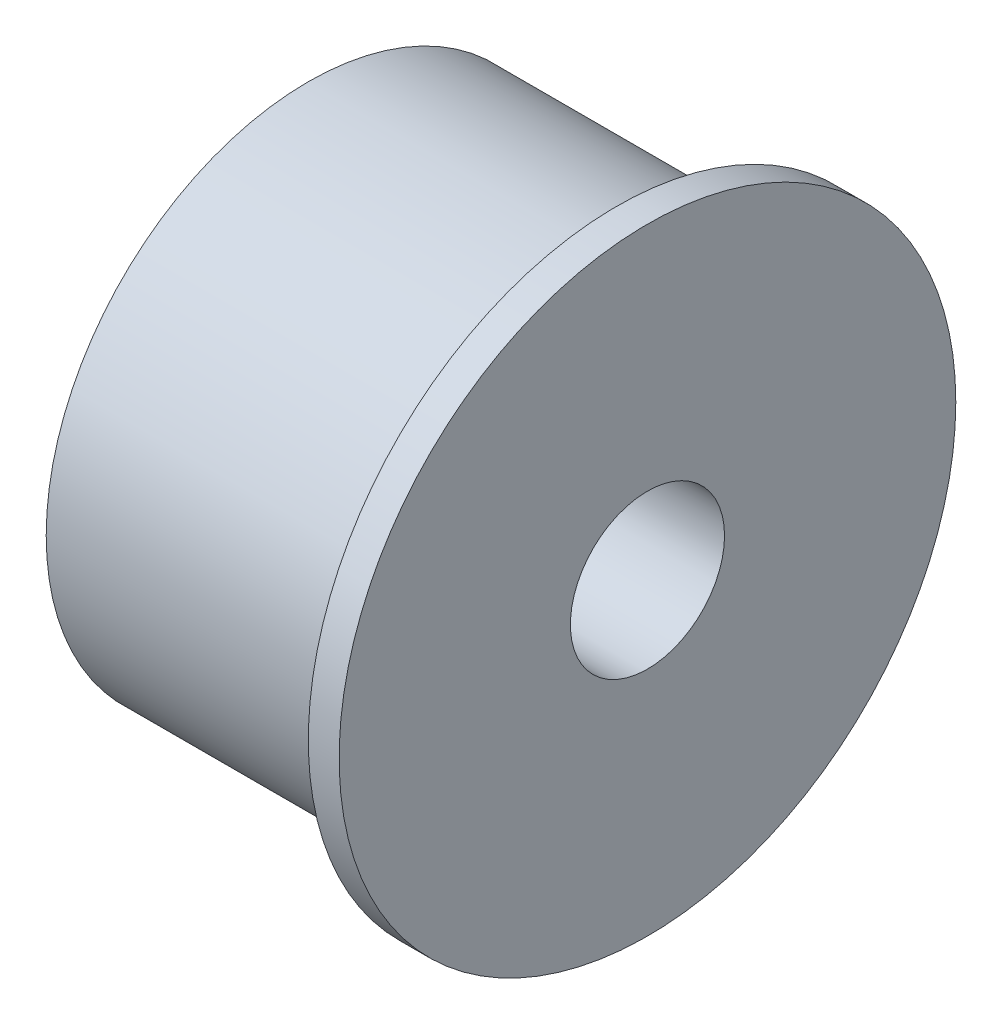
SolidWorks part; units mm, degrees
ref_plane "Face" through (0, 0, 0) normal (0, 0, 1) x (1, 0, 0)
ref_plane "Dessus" through (0, 0, 0) normal (0, 1, 0) x (1, 0, 0)
ref_plane "Droite" through (0, 0, 0) normal (1, 0, 0) x (0, 0, -1)
sketch "Esquisse1" plane through (0, 0, 0) normal (0, 0, 1) x (1, 0, 0)
  line L0 (0, 0) -> (-77.3171, 0) construction
  line L1 (-64.0843, 17) -> (-64.0843, 5)
  line L2 (-42.0843, 20) -> (-44.0843, 20)
  line L3 (-44.0843, 20) -> (-44.0843, 17)
  line L4 (-44.0843, 17) -> (-64.0843, 17)
  line L5 (-64.0843, 5) -> (-42.0843, 5)
  line L6 (-42.0843, 5) -> (-42.0843, 20)
  dimension "D1" = 10
  dimension "D2" = 17
  dimension "D3" = 20
  dimension "D4" = 2
  dimension "D5" = 22
revolve "Base-Révolution" add sketch "Esquisse1" angle 360 about L0
